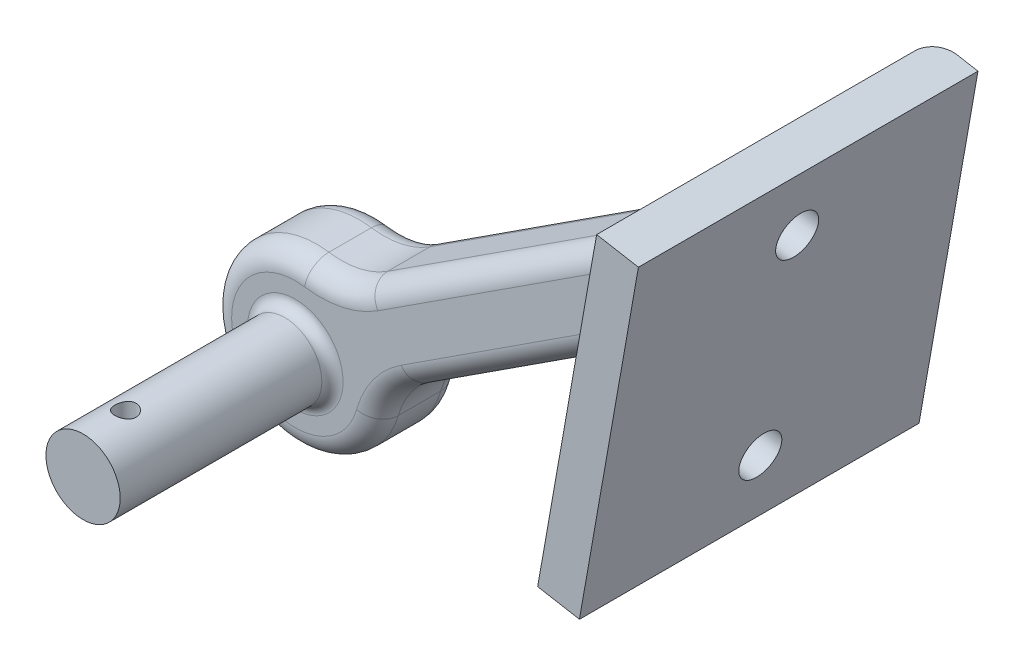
SolidWorks part; units mm, degrees
ref_plane "Front" through (0, 0, 0) normal (0, 0, 1) x (1, 0, 0)
ref_plane "Top" through (0, 0, 0) normal (0, 1, 0) x (1, 0, 0)
ref_plane "Right" through (0, 0, 0) normal (1, 0, 0) x (0, 0, -1)
sketch "Sketch1" plane through (0, 0, 0) normal (0, 0, 1) x (1, 0, 0)
  line L0 (0, 0) -> (25.4, 144.0506) construction
  line L1 (25.4, 144.0506) -> (25.4, 0) construction
  line L2 (25.4, 0) -> (0, 0) construction
  line L3 (4.4107, 25.0141) -> (-1.8429, 26.1168)
  line L4 (-1.8429, 26.1168) -> (6.9785, 76.145)
  line L5 (6.9785, 76.145) -> (13.232, 75.0424)
  line L6 (13.232, 75.0424) -> (4.4107, 25.0141)
  line L7 (-76.2, 0) -> (2.5678, 51.1309) construction
  circle A0 centre (-76.2, 0) radius 12.7
  dimension "D1" = 25.4
  dimension "D2" = 76.2
  dimension "D3" = 50.8
  dimension "D4" = 25.4
  dimension "D5" = 6.35
  dimension "D6" = 10
  dimension "D7" = 25.4
sketch "Sketch2" plane through (0, 0, 0) normal (0, 0, 1) x (1, 0, 0)
  line L0 (-1.8429, 26.1168) -> (6.9785, 76.145) construction
  line L1 (1.0604, 42.5818) -> (4.0752, 59.68)
  line L2 (-56.7711, 12.612) -> (60.7287, 88.8851) construction
  line L3 (-76.2, 0) -> (2.5678, 51.1309) construction
  line L4 (-70.4321, 11.3147) -> (4.0752, 59.68)
  line L5 (-63.5173, 0.6622) -> (1.0604, 42.5818)
  circle A0 centre (-76.2, 0) radius 12.7 construction
  arc A1 (-70.4321, 11.3147) -> (-63.5173, 0.6622) centre (-76.2, 0) ccw
  dimension "D1" = 12.7
extrude "Base-Extrude" add sketch "Sketch2" along normal blind 12.7
sketch "Sketch3" plane through (0, 0, 0) normal (0, 0, 1) x (1, 0, 0)
  line L4 (4.4107, 25.0141) -> (-1.8429, 26.1168)
  line L5 (13.232, 75.0424) -> (4.4107, 25.0141)
  line L6 (6.9785, 76.145) -> (13.232, 75.0424)
  line L7 (-1.8429, 26.1168) -> (6.9785, 76.145)
  line L8 (4.4107, 25.0141) -> (-1.8429, 26.1168)
  line L9 (13.232, 75.0424) -> (4.4107, 25.0141)
  line L10 (6.9785, 76.145) -> (13.232, 75.0424)
  line L11 (-1.8429, 26.1168) -> (6.9785, 76.145)
  dimension "D1" = 0
extrude "Boss-Extrude1" add sketch "Sketch3" along normal blind 50.8
fillet "Fillet1" radius 12.7 2 edges at (-63.5173, 0.6622, 6.35) (-70.4321, 11.3147, 6.35)
sketch "Sketch5" plane through (-6.2535, 1.1027, 0) normal (-0.9848, 0.1736, 0) x (0, 0, 1)
  line L0 (25.4, 76.2) -> (25.4, 25.4) construction
  line L1 (50.8, 76.2) -> (0, 76.2) construction
  line L2 (50.8, 25.4) -> (0, 25.4) construction
  circle A0 centre (25.4, 66.675) radius 3.175
  circle A1 centre (25.4, 34.925) radius 3.175
  dimension "D3" = 6.35
  dimension "D4" = 6.35
  dimension "D1" = 9.525
  dimension "D2" = 9.525
extrude "Cut-Extrude2" cut sketch "Sketch5" against normal through all
fillet "Fillet4" radius 9.525 2 edges at (4.0752, 59.68, 6.35) (1.0604, 42.5818, 6.35)
fillet "Fillet5" radius 3.175 15 edges at (-37.4064, 17.6117, 0) (-37.4064, 17.6117, 12.7) (-86.8524, -6.9149, 0) (-86.8524, -6.9149, 12.7) (-32.4826, 35.9491, 0) (-32.4826, 35.9491, 12.7) (-61.9703, 0.6885, 0) (-61.9703, 0.6885, 12.7) (-69.7784, 12.717, 0) (-69.7784, 12.717, 12.7) (5.8865, 69.9524, 0) (-7.6778, 32.3485, 0) (-7.6778, 32.3485, 12.7) (3.3566, 60.1558, 0) (3.3566, 60.1558, 12.7)
sketch "Sketch6" plane through (0, 0, 12.7) normal (0, 0, 1) x (1, 0, 0)
  circle A0 centre (-76.2, 0) radius 5.5563
  dimension "D1" = 11.1125
extrude "Boss-Extrude2" add sketch "Sketch6" along normal blind 31.75
fillet "Fillet9" radius 1.5875 5 edges at (-70.6438, 0, 12.7) (1.195, 43.3451, 12.7) (2.8414, 55.1119, 12.7) (3.8228, 58.2485, 12.236) (-1.6488, 27.2176, 11.3088)
sketch "Sketch7" plane through (0, 0, 0) normal (0, 1, 0) x (1, 0, 0)
  line L0 (-76.2, -9.525) -> (-76.2, -3.175) construction
  line L1 (1.5012, -12.7) -> (-63.8369, -12.7) construction
  circle A0 centre (-76.2, -38.1) radius 1.5875
  dimension "D1" = 3.175
  dimension "D2" = 25.4
extrude "Cut-Extrude3" cut sketch "Sketch7" along normal through all and the other way through all
